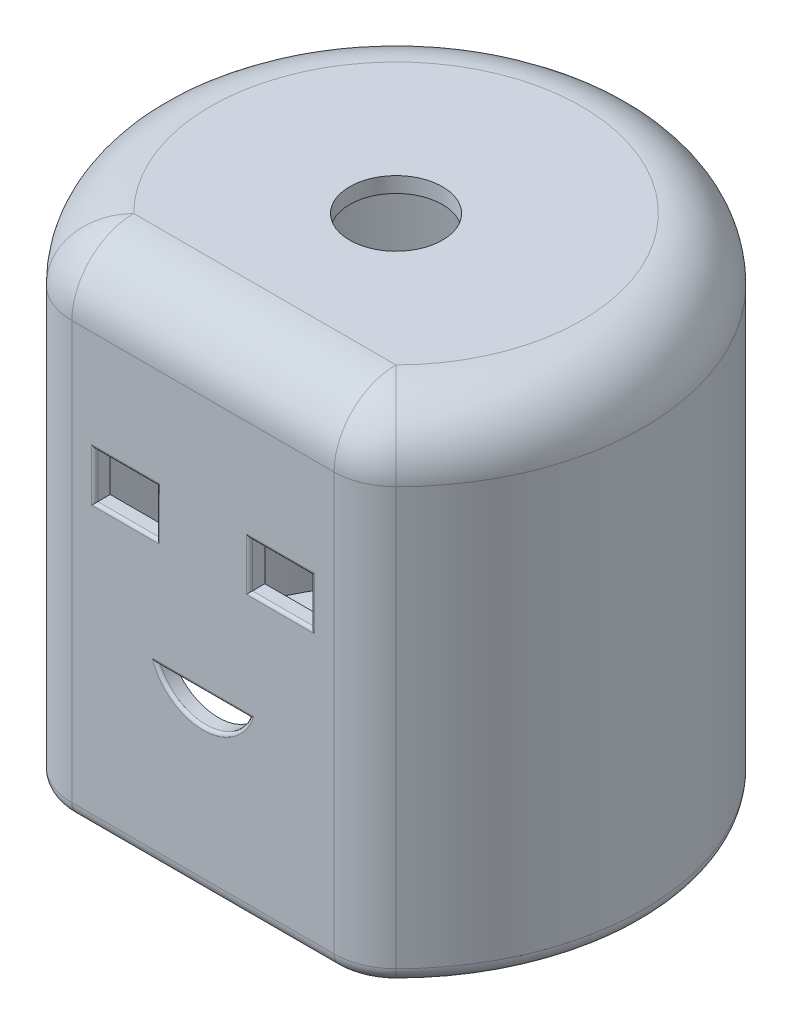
SolidWorks part; units mm, degrees
ref_plane "Front Plane" through (0, 0, 0) normal (0, 0, 1) x (1, 0, 0)
ref_plane "Top Plane" through (0, 0, 0) normal (0, 1, 0) x (1, 0, 0)
ref_plane "Right Plane" through (0, 0, 0) normal (1, 0, 0) x (0, 0, -1)
sketch "Sketch4" plane through (0, 0, 0) normal (0, 1, 0) x (1, 0, 0)
  line L0 (-63.5, -79.3115) -> (63.5, -79.3115)
  line L1 (0, 0) -> (0, -79.3115) construction
  circle A0 centre (0, 0) radius 101.6 construction
  arc A1 (-63.5, -79.3115) -> (63.5, -79.3115) centre (0, 0) cw
  dimension "D3" = 203.2
  dimension "D1" = 127
extrude "Boss-Extrude2" add sketch "Sketch4" along normal blind 203.2
fillet "Fillet3" radius 25.4 4 edges at (0, 203.2, 79.3115) (0, 203.2, -101.6) (-63.5, 101.6, 79.3115) (63.5, 101.6, 79.3115)
fillet "Fillet4" radius 6.35 4 edges at (-63.5652, 0, 77.3807) (0, 0, 79.3115) (63.5652, 0, 77.3807) (0, 0, -101.6)
shell "Shell1" thickness 6.35
sketch "Sketch6" plane through (0, 0, 79.3115) normal (0, 0, 1) x (1, 0, 0)
  line L0 (0, 0) -> (0, 177.8) construction
  line L1 (19.05, 136.525) -> (44.45, 136.525)
  line L2 (19.05, 136.525) -> (19.05, 117.475)
  line L3 (19.05, 117.475) -> (44.45, 117.475)
  line L4 (44.45, 136.525) -> (44.45, 117.475)
  line L5 (19.05, 136.525) -> (44.45, 117.475) construction
  line L6 (19.05, 117.475) -> (44.45, 136.525) construction
  line L7 (53.8516, 177.8) -> (-53.8516, 177.8) construction
  line L8 (31.75, 127) -> (0, 127) construction
  line L9 (-19.05, 117.475) -> (-44.45, 117.475)
  line L10 (-44.45, 136.525) -> (-44.45, 117.475)
  line L11 (-19.05, 136.525) -> (-44.45, 136.525)
  line L12 (-19.05, 136.525) -> (-19.05, 117.475)
  line L13 (-19.05, 73.025) -> (19.05, 73.025)
  line L14 (0, 60.325) -> (0, 73.025) construction
  arc A0 (-19.05, 73.025) -> (19.05, 73.025) centre (0, 80.9625) ccw
  point P0 (31.75, 127)
  point P19 (0, 73.025)
  dimension "D7" = 12.7
  dimension "D1" = 25.4
  dimension "D2" = 19.05
  dimension "D3" = 127
  dimension "D4" = 31.75
  dimension "D5" = 38.1
  dimension "D6" = 44.45
extrude "Cut-Extrude1" cut sketch "Sketch6" against normal blind 12.7
sketch "Sketch7" plane through (0, 203.2, 0) normal (0, 1, 0) x (1, 0, 0)
  circle A0 centre (0, 0) radius 19.05
  dimension "D1" = 38.1
extrude "Cut-Extrude2" cut sketch "Sketch7" against normal through all
fillet "Fillet5" radius 1.27 10 edges at (-44.45, 127, 79.3115) (-31.75, 117.475, 79.3115) (-19.05, 127, 79.3115) (-31.75, 136.525, 79.3115) (19.05, 127, 79.3115) (31.75, 117.475, 79.3115) (44.45, 127, 79.3115) (31.75, 136.525, 79.3115) (0, 60.325, 79.3115) (0, 73.025, 79.3115)
sketch "Sketch8" plane through (0, 0, 0) normal (0, 1, 0) x (1, 0, 0)
  line L0 (53.8516, -72.9615) -> (-53.8516, -72.9615) construction
  line L1 (53.8516, -72.9615) -> (-53.8516, -72.9615)
  line L2 (53.8516, -60.2615) -> (-53.8516, -60.2615)
  arc A0 (53.8516, -72.9615) -> (67.3145, -67.3893) centre (53.8516, -53.9115) ccw construction
  arc A1 (67.3145, -67.3893) -> (-67.3145, -67.3893) centre (0, 0) ccw construction
  arc A2 (-67.3145, -67.3893) -> (-53.8516, -72.9615) centre (-53.8516, -53.9115) ccw construction
  arc A3 (53.8516, -72.9615) -> (67.3145, -67.3893) centre (53.8516, -53.9115) ccw
  arc A4 (67.3145, -67.3893) -> (-67.3145, -67.3893) centre (0, 0) ccw
  arc A5 (-67.3145, -67.3893) -> (-53.8516, -72.9615) centre (-53.8516, -53.9115) ccw
  arc A6 (-58.3392, -58.4041) -> (-53.8516, -60.2615) centre (-53.8516, -53.9115) ccw
  arc A7 (58.3392, -58.4041) -> (-58.3392, -58.4041) centre (0, 0) ccw
  arc A8 (53.8516, -60.2615) -> (58.3392, -58.4041) centre (53.8516, -53.9115) ccw
  dimension "D1" = 12.7
extrude "Boss-Extrude3" add sketch "Sketch8" along normal blind 3.81
